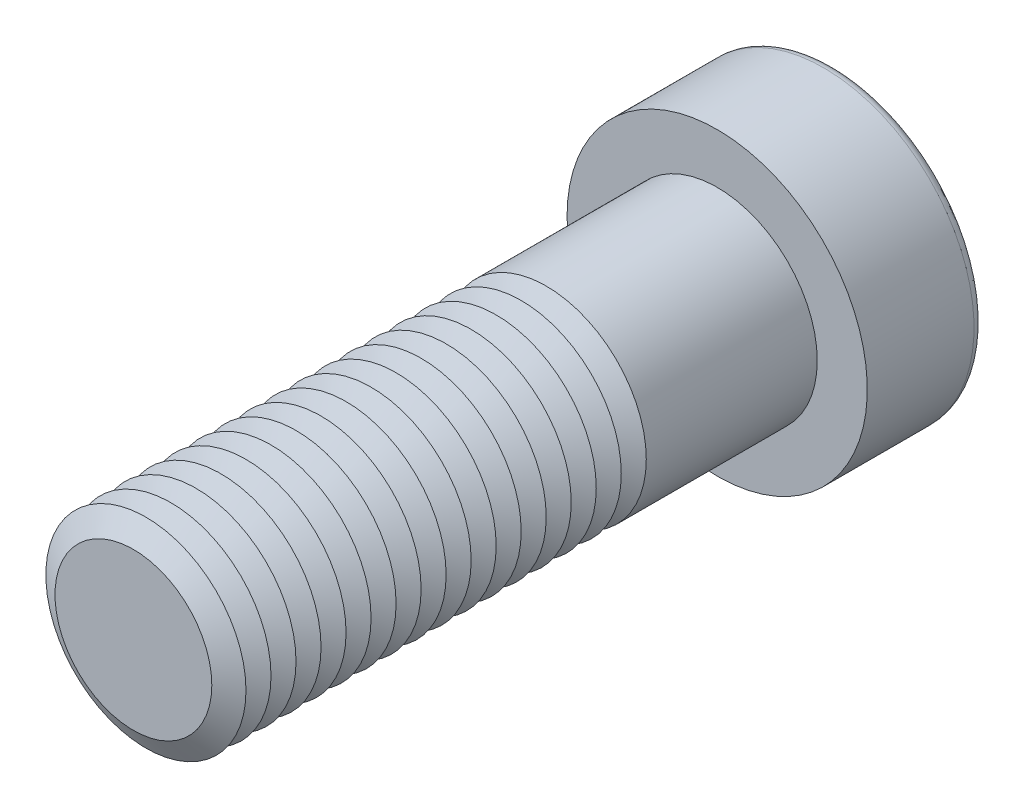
SolidWorks part; units mm, degrees
ref_plane "Front Plane" through (0, 0, 0) normal (0, 0, 1) x (1, 0, 0)
ref_plane "Top Plane" through (0, 0, 0) normal (0, 1, 0) x (1, 0, 0)
ref_plane "Right Plane" through (0, 0, 0) normal (1, 0, 0) x (0, 0, -1)
sketch "Sketch1" plane through (0, 0, 0) normal (0, 0, 1) x (1, 0, 0)
  circle A0 centre (0, 0) radius 12
  dimension "D1" = 24
extrude "Boss-Extrude1" add sketch "Sketch1" along normal blind 70
sketch "Sketch2" plane through (0, 0, 0) normal (0, 0, -1) x (-1, 0, 0)
  circle A0 centre (0, 0) radius 18
  dimension "D1" = 36
extrude "Boss-Extrude2" add sketch "Sketch2" along normal blind 14
sketch "Sketch3" plane through (0, 0, -14) normal (0, 0, -1) x (-1, 0, 0)
  line L1 (-5.4848, 9.5) -> (-10.9697, 0)
  line L2 (-10.9697, 0) -> (-5.4848, -9.5)
  line L3 (-5.4848, -9.5) -> (5.4848, -9.5)
  line L4 (5.4848, -9.5) -> (10.9697, 0)
  line L5 (10.9697, 0) -> (5.4848, 9.5)
  line L6 (5.4848, 9.5) -> (-5.4848, 9.5)
  circle A0 centre (0, 0) radius 9.5 construction
  dimension "D1" = 19
extrude "Cut-Extrude1" cut sketch "Sketch3" against normal blind 14.25
fillet "Fillet1" radius 1.2 1 edges at (-18, 0, -14)
sketch "Sketch4" plane through (0, 0, 0.25) normal (0, 0, -1) x (-1, 0, 0)
  line L0 (5.4848, -9.5) -> (10.9697, 0) construction
  circle A0 centre (0, 0) radius 9.5
extrude "Cut-Extrude2" cut sketch "Sketch4" against normal through all draft 60
sketch "Sketch5" plane through (0, 0, -14) normal (0, 0, -1) x (-1, 0, 0)
  circle A0 centre (0, 0) radius 10.9697
extrude "Cut-Extrude3" cut sketch "Sketch5" against normal through all draft 75
sketch "Sketch7" plane through (0, 0, 0) normal (1, 0, 0) x (0, 0, -1)
  line L25 (-70, 9.4019) -> (-68.5, 12)
  line L26 (-70, 12) -> (-70, -12) construction
  line L27 (-68.5, 12) -> (-71.5, 12)
  line L28 (-71.5, 12) -> (-70, 9.4019)
  line L29 (0, 12) -> (-70, 12) construction
  dimension "D1" = 3
revolve "Cut-Revolve1" cut sketch "Sketch7" angle 360 about axis through (0, 0, 70) along (0, 0, -1)
pattern_linear "LPattern1" count 17 spacing 3 along (0, 0, -1) of "Cut-Revolve1"
